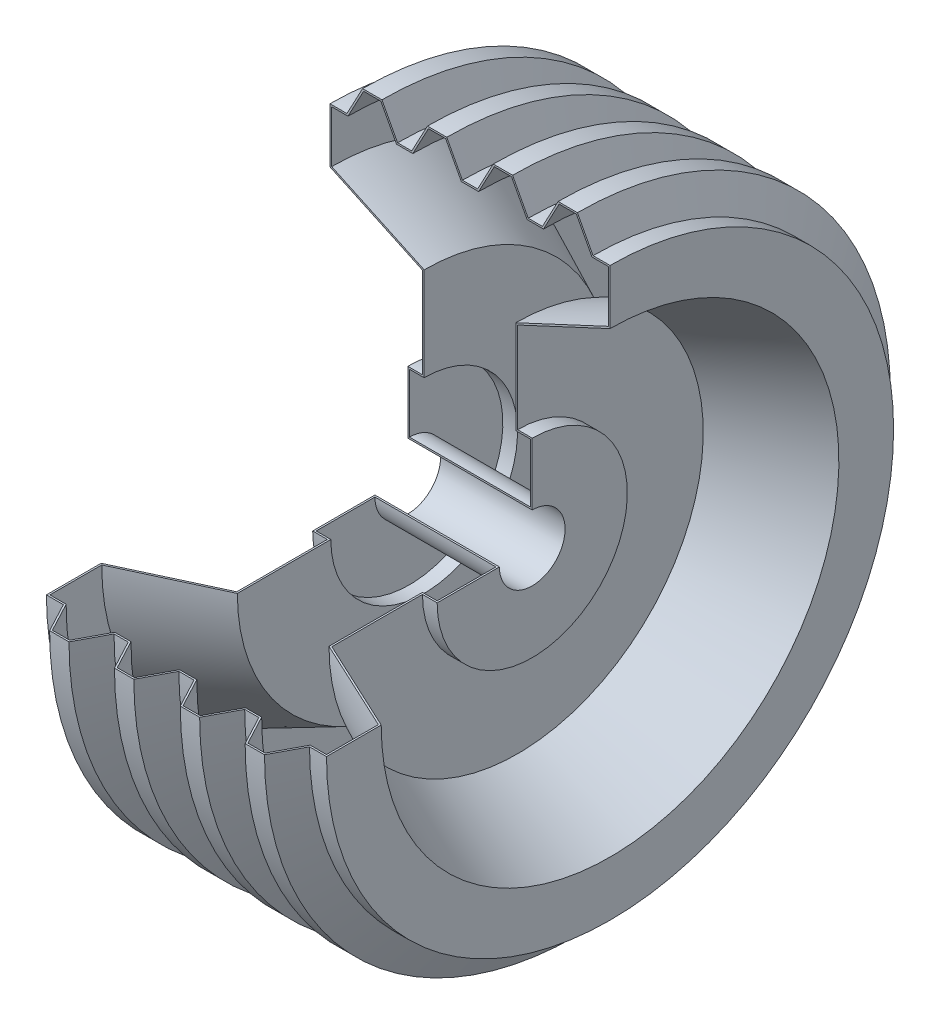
SolidWorks part; units mm, degrees
ref_plane "Front Plane" through (0, 0, 0) normal (0, 0, 1) x (1, 0, 0)
ref_plane "Top Plane" through (0, 0, 0) normal (0, 1, 0) x (1, 0, 0)
ref_plane "Right Plane" through (0, 0, 0) normal (1, 0, 0) x (0, 0, -1)
sketch "Sketch1" plane through (0, 0, 0) normal (0, 0, 1) x (1, 0, 0)
  line L0 (-137.2348, 0) -> (166.523, 0) construction
  line L1 (0, 262.9035) -> (0, -75.2471) construction
  line L2 (-35, 20) -> (35, 20)
  line L3 (35, 20) -> (35, 54)
  line L4 (-35, 20) -> (-35, 54)
  line L5 (35, 54) -> (26.5, 54)
  line L6 (-35, 54) -> (-26.5, 54)
  line L7 (26.5, 54) -> (26.5, 108.0525)
  line L8 (-26.5, 54) -> (-26.5, 108.0525)
  line L9 (26.5, 108.0525) -> (80, 133)
  line L10 (-26.5, 108.0525) -> (-80, 133)
  line L11 (80, 133) -> (80, 163)
  line L12 (-80, 133) -> (-80, 163)
  line L13 (80, 163) -> (70.5781, 163)
  line L14 (-80, 163) -> (-70.5781, 163)
  line L15 (70.5781, 163) -> (61.5391, 180)
  line L16 (-70.5781, 163) -> (-61.5391, 180)
  line L17 (61.5391, 180) -> (51.5391, 180)
  line L18 (-61.5391, 180) -> (-51.5391, 180)
  line L19 (51.5391, 180) -> (42.5, 163)
  line L20 (-51.5391, 180) -> (-42.5, 163)
  line L21 (42.5, 163) -> (33.0781, 163)
  line L22 (-42.5, 163) -> (-33.0781, 163)
  line L23 (33.0781, 163) -> (24.0391, 180)
  line L24 (-33.0781, 163) -> (-24.0391, 180)
  line L25 (24.0391, 180) -> (14.0391, 180)
  line L26 (-24.0391, 180) -> (-14.0391, 180)
  line L27 (14.0391, 180) -> (5, 163)
  line L28 (-14.0391, 180) -> (-5, 163)
  line L29 (5, 163) -> (-5, 163)
  point P7 (0, 20)
  point P34 (0, 163)
  dimension "D1" = 10
  dimension "D2" = 160
  dimension "D3" = 62
  dimension "D4" = 360
  dimension "D5" = 40
  dimension "D6" = 108
  dimension "D7" = 53
  dimension "D8" = 70
  dimension "D9" = 65
  dimension "D10" = 30
  dimension "D11" = 17
revolve "Revolve-Thin1" add sketch "Sketch1" angle 270 about L0
